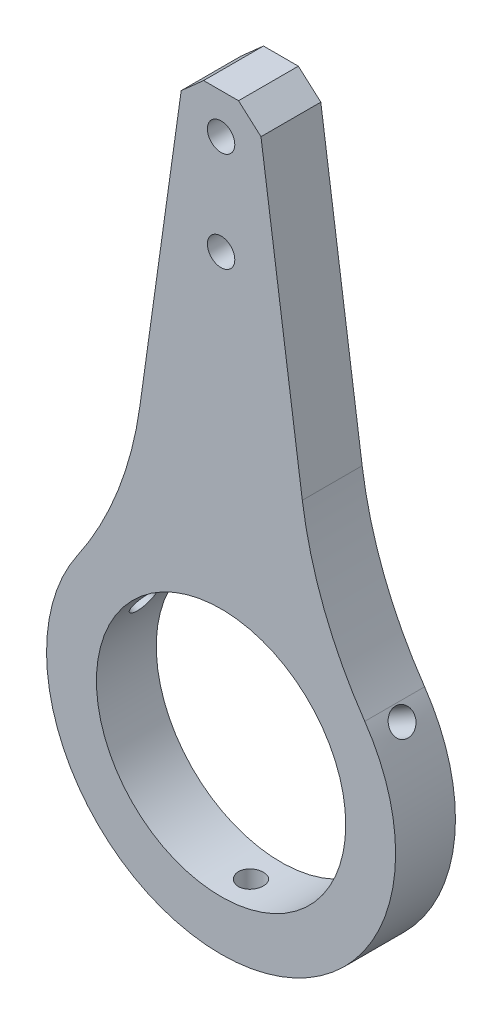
SolidWorks part; units mm, degrees
ref_plane "Plan de face" through (0, 0, 0) normal (0, 0, 1) x (1, 0, 0)
ref_plane "Plan de dessus" through (0, 0, 0) normal (0, 1, 0) x (1, 0, 0)
ref_plane "Plan de droite" through (0, 0, 0) normal (1, 0, 0) x (0, 0, -1)
sketch "Esquisse1" plane through (0, 0, 0) normal (0, 0, 1) x (1, 0, 0)
  line L0 (0, 133.6845) -> (0, -43.7904) construction
  line L1 (-16.2919, 52.0002) -> (-8, 111)
  line L2 (-8, 111) -> (-3.5, 115)
  line L3 (-3.5, 115) -> (3.5, 115)
  line L4 (8, 111) -> (3.5, 115)
  line L5 (16.2919, 52.0002) -> (8, 111)
  circle A0 centre (0, 0) radius 25
  arc A1 (-28.8152, 19.8667) -> (28.8152, 19.8667) centre (0, 0) ccw
  arc A2 (-28.8152, 19.8667) -> (-16.2919, 52.0002) centre (-90.562, 62.4382) ccw
  circle A3 centre (0, 87) radius 2.75
  circle A4 centre (0, 107) radius 2.75
  arc A5 (28.8152, 19.8667) -> (16.2919, 52.0002) centre (90.562, 62.4382) cw
  point P17 (0, 115)
  dimension "D1" = 50
  dimension "D2" = 70
  dimension "D4" = 75
  dimension "D9" = 5.5
  dimension "D10" = 5.5
  dimension "D3" = 115
  dimension "D5" = 16
  dimension "D6" = 4.5
  dimension "D7" = 4
  dimension "D11" = 8
  dimension "D12" = 20
  dimension "D13" = 8
extrude "Extrusion1" add sketch "Esquisse1" along normal blind 12
ref_plane "Plan1" through (0, -35, 6) normal (0, -1, 0) x (-1, 0, 0)
sketch "Esquisse2" plane through (0, -35, 6) normal (0, -1, 0) x (-1, 0, 0)
  line L0 (-35, -6) -> (35, -6) construction
  line L1 (0, 12.3362) -> (0, -14.648) construction
  circle A0 centre (0, 0) radius 2.5
  dimension "D2" = 5
  dimension "D1" = 6
extrude "Extrusion2" cut sketch "Esquisse2" against normal blind 12
pattern_circular "Répétition circulaire1" count 3 over 360 about axis through (0, 0, 12) along (0, 0, 1) of "Extrusion2"
